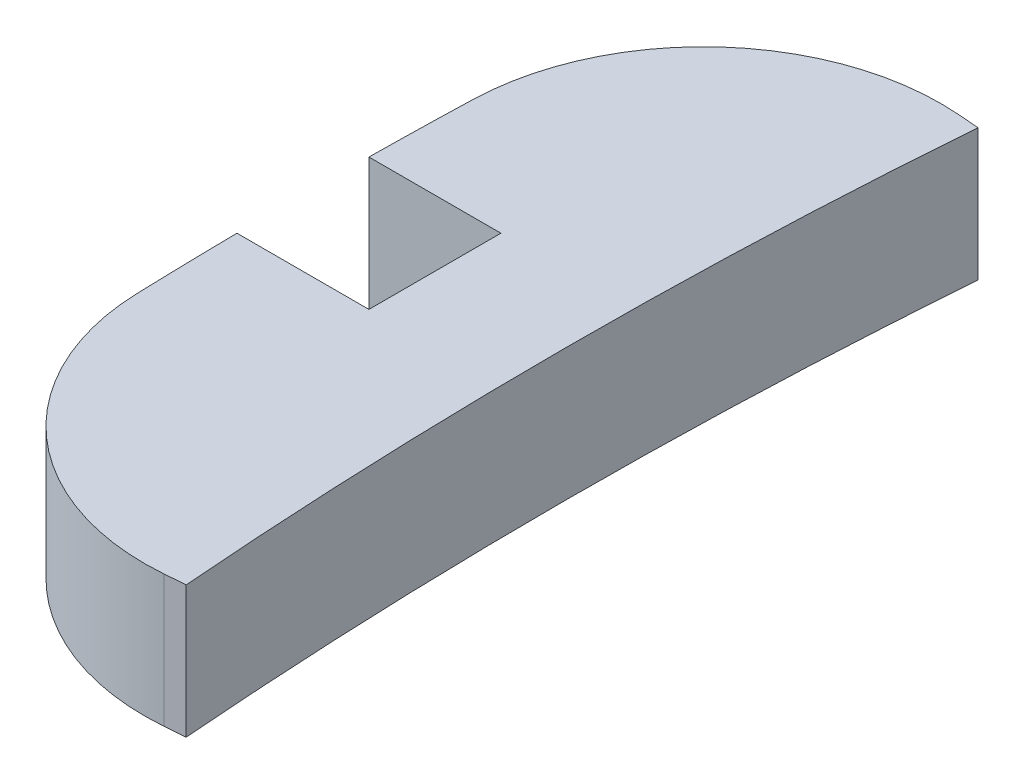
SolidWorks part; units mm, degrees
ref_plane "Ebene vorne" through (0, 0, 0) normal (0, 0, 1) x (1, 0, 0)
ref_plane "Ebene oben" through (0, 0, 0) normal (0, 1, 0) x (1, 0, 0)
ref_plane "Ebene rechts" through (0, 0, 0) normal (1, 0, 0) x (0, 0, -1)
sketch "Skizze2" plane through (0, 0, 0) normal (0, 1, 0) x (1, 0, 0)
  line L0 (-190.8953, 15.062) -> (-190.1092, 15)
  line L1 (-190.8953, -15.062) -> (-190.1092, -15)
  line L2 (-190.1092, 15) -> (-190.1092, -15) construction
  line L3 (-188.7068, 2.5) -> (-189.4871, 2.5) construction
  line L4 (-195.6844, 2.5) -> (-200.6844, 2.5)
  line L5 (-195.6844, 2.5) -> (-195.6844, -2.5)
  line L6 (-195.6844, -2.5) -> (-200.6844, -2.5)
  circle A0 centre (0, 0) radius 190.7 construction
  arc A1 (-190.1092, 15) -> (-190.1092, -15) centre (0, 0) ccw
  arc A2 (-200.5987, 6.3758) -> (-200.6844, 2.5) centre (0, 0) ccw
  circle A3 centre (0, 0) radius 190.7 construction
  circle A4 centre (0, 0) radius 200.7 construction
  arc A5 (-200.6844, -2.5) -> (-200.5987, -6.3758) centre (0, 0) ccw
  arc A6 (-190.8953, 15.062) -> (-200.5987, 6.3758) centre (-191.6032, 6.0899) ccw
  arc A7 (-190.8953, -15.062) -> (-200.5987, -6.3758) centre (-191.6032, -6.0899) cw
  dimension "D4" = 9
  dimension "D2" = 30
  dimension "D3" = 5
  dimension "D1" = 10
extrude "Aufsatz-Linear austragen1" add sketch "Skizze2" along normal blind 5
